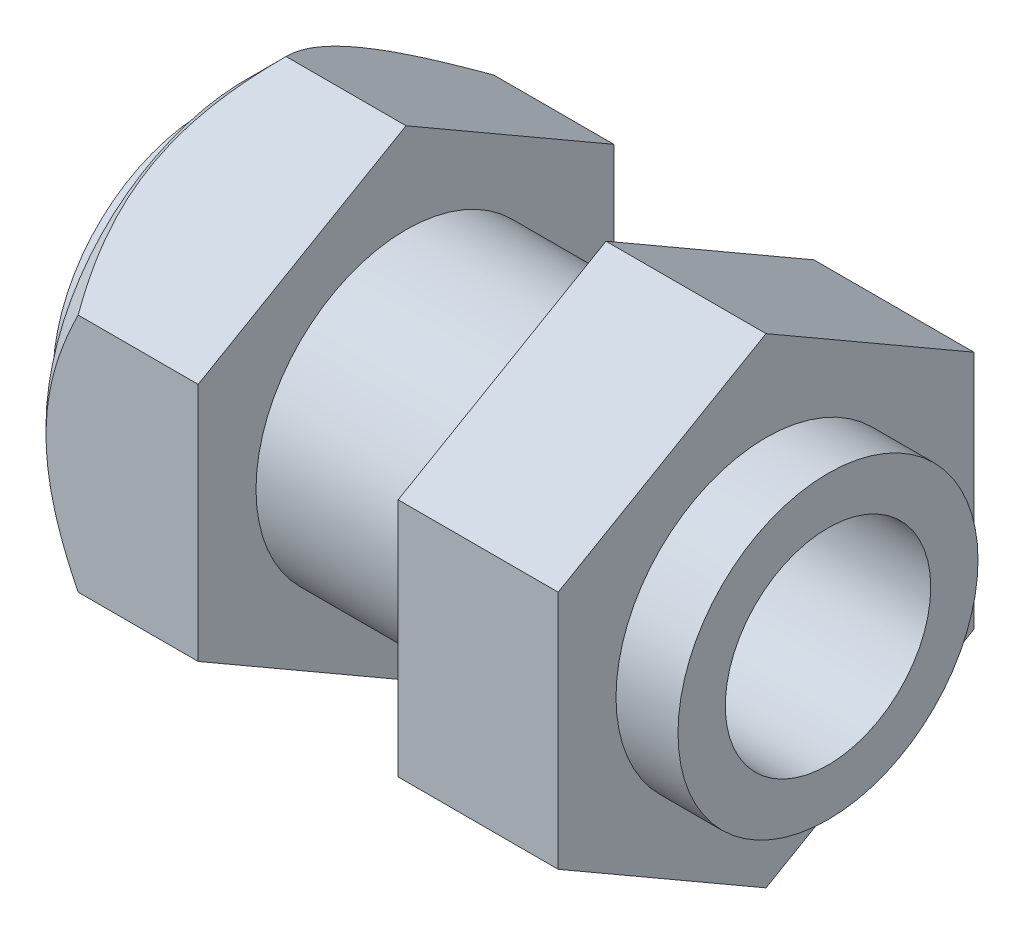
SolidWorks part; units mm, degrees
ref_plane "Plan de face" through (0, 0, 0) normal (0, 0, 1) x (1, 0, 0)
ref_plane "Plan de dessus" through (0, 0, 0) normal (0, 1, 0) x (1, 0, 0)
ref_plane "Plan de droite" through (0, 0, 0) normal (1, 0, 0) x (0, 0, -1)
sketch "Esquisse1" plane through (0, 0, 170) normal (0, 0, -1) x (-1, 0, 0)
  line L0 (429.9569, -62.9265) -> (421.9569, -62.9265)
  line L1 (429.9569, -75.1108) -> (454.0678, -75.1108) construction
  line L2 (429.9569, -286.62) -> (429.9569, -55.1108) construction
  line L3 (421.9569, -62.9265) -> (421.9569, -67.6108)
  line L4 (424.9569, -69.9741) -> (444.9569, -69.9741)
  line L5 (447.9569, -67.4567) -> (447.9569, -63.1108)
  line L6 (447.9569, -63.1108) -> (439.9569, -63.1108)
  line L7 (439.9569, -55.1108) -> (439.9569, -275.62) construction
  line L8 (439.9569, -63.1108) -> (439.9569, -67.6108)
  line L9 (439.9569, -67.6108) -> (429.9569, -67.6108)
  line L10 (429.9569, -67.6108) -> (429.9569, -62.9265)
  line L12 (424.9569, -69.9741) -> (418.858, -69.9741)
  line L14 (421.9569, -67.6108) -> (418.858, -67.6108)
  line L15 (418.858, -69.9741) -> (418.858, -67.6108)
  line L16 (444.9569, -69.9741) -> (449.9493, -69.9741)
  line L18 (447.9569, -67.4567) -> (449.9493, -67.4567)
  line L19 (449.9493, -69.9741) -> (449.9493, -67.4567)
  dimension "D1" = 5.1367
  dimension "D2" = 7.5
  dimension "D3" = 8
  dimension "D4" = 8
  dimension "D5" = 12.1843
  dimension "D6" = 12
revolve "Révolution1" add sketch "Esquisse1" angle 360 about L1
chamfer "Chanfrein1" distance 2 angle 45 1 edges at (-447.9569, -75.1108, 158)
sketch "Esquisse2" plane through (-447.9569, 0, 0) normal (-1, 0, 0) x (0, 0, 1)
  line L0 (170, -252.0043) -> (170, -511.0644) construction
  line L1 (170, -63.1108) -> (159.6077, -69.1108)
  line L2 (159.6077, -69.1108) -> (159.6077, -81.1108)
  line L3 (159.6077, -81.1108) -> (170, -87.1108)
  line L4 (170, -87.1108) -> (180.3923, -81.1108)
  line L5 (180.3923, -81.1108) -> (180.3923, -69.1108)
  line L6 (180.3923, -69.1108) -> (170, -63.1108)
  circle A0 centre (170, -75.1108) radius 10.3923 construction
  circle A1 centre (170, -75.1108) radius 12 construction
extrude "Enlèv. mat.-Extru.1" cut sketch "Esquisse2" against normal through all flip side to cut
